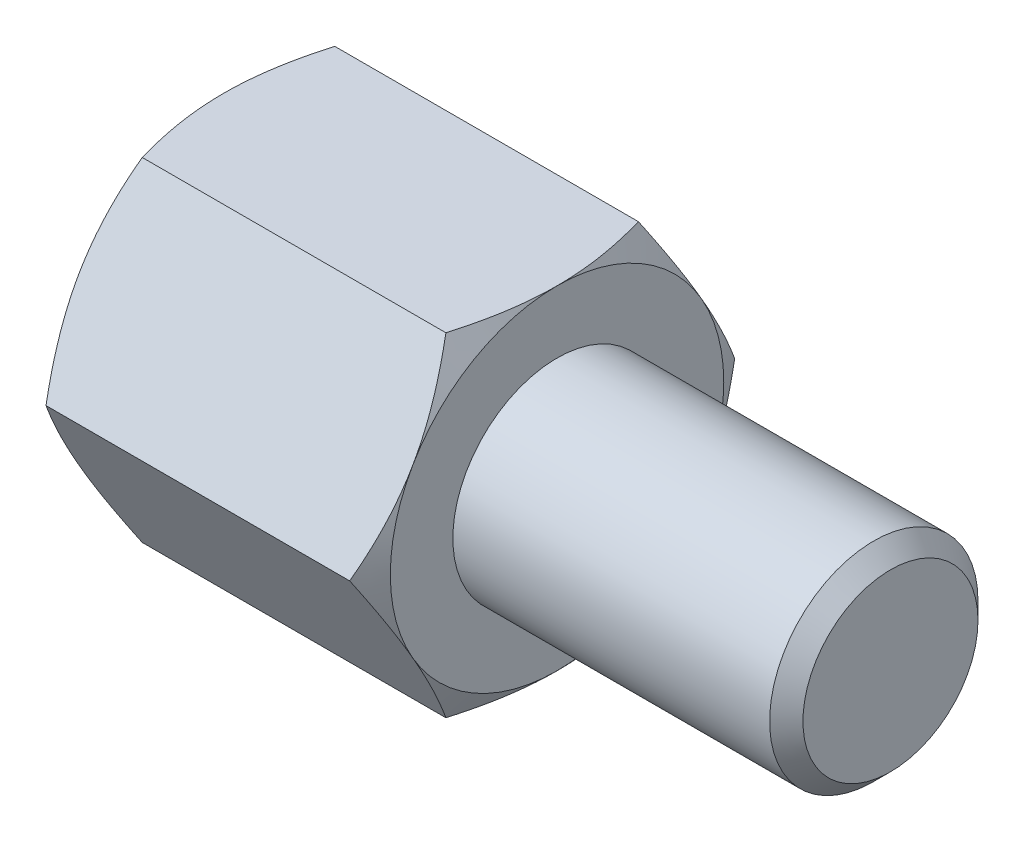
SolidWorks part; units mm, degrees
ref_plane "Front Plane" through (0, 0, 0) normal (0, 0, 1) x (1, 0, 0)
ref_plane "Top Plane" through (0, 0, 0) normal (0, 1, 0) x (1, 0, 0)
ref_plane "Right Plane" through (0, 0, 0) normal (1, 0, 0) x (0, 0, -1)
sketch "Sketch1" plane through (0, 0, 0) normal (1, 0, 0) x (0, 0, -1)
  line L1 (2.3094, 4) -> (-2.3094, 4)
  line L2 (-2.3094, 4) -> (-4.6188, 0)
  line L3 (-4.6188, 0) -> (-2.3094, -4)
  line L4 (-2.3094, -4) -> (2.3094, -4)
  line L5 (2.3094, -4) -> (4.6188, 0)
  line L6 (4.6188, 0) -> (2.3094, 4)
  circle A0 centre (0, 0) radius 4 construction
  dimension "D1" = 8
extrude "Extrude2" add sketch "Sketch1" along normal mid plane 8
sketch "Sketch2" plane through (0, 0, 0) normal (0, 0, 1) x (1, 0, 0)
  line L0 (-4, 4) -> (-2.5, 6.5981)
  line L1 (-4, 7) -> (-4, 4)
  line L3 (0, 0) -> (50000, 0) construction
  arc A0 (-2.5, 6.5981) -> (-4, 7) centre (-3.1962, 7) ccw
  dimension "D1" = 30
  dimension "D2" = 3
revolve "Cut-Revolve1" cut sketch "Sketch2" angle 360 about L3
mirror "Mirror1" about plane through (0, 0, 0) normal (1, 0, 0) of "Cut-Revolve1"
sketch "Sketch3" plane through (-4, 0, 0) normal (-1, 0, 0) x (0, 0, 1)
  circle A0 centre (0, 0) radius 2.1
  dimension "D1" = 4.2
extrude "Extrude3" cut sketch "Sketch3" against normal blind 5
sketch "Sketch4" plane through (0, 0, 0) normal (0, 0, 1) x (1, 0, 0)
  line L0 (1, 0) -> (1, 2.1)
  line L1 (3.6427, 0) -> (-3.6427, 0) construction
  line L2 (1, 2.1) -> (2.2124, 0)
  line L3 (2.2124, 0) -> (1, 0)
  line L4 (-4, 2) -> (-4, -2) construction
  point P4 (-4, 0)
  dimension "D1" = 30
  dimension "D2" = 2.1
  dimension "D3" = 5
revolve "Cut-Revolve2" cut sketch "Sketch4" angle 360 about L3
sketch "Sketch5" plane through (4, 0, 0) normal (1, 0, 0) x (0, 0, -1)
  circle A0 centre (0, 0) radius 2.5
  dimension "D1" = 5
extrude "Extrude4" add sketch "Sketch5" along normal blind 8
chamfer "Chamfer1" distance 0.4 angle 45 1 edges at (12, 0, -2.5)
equation "\"D2@Sketch4\" = \"D1@Sketch3\"/2"
